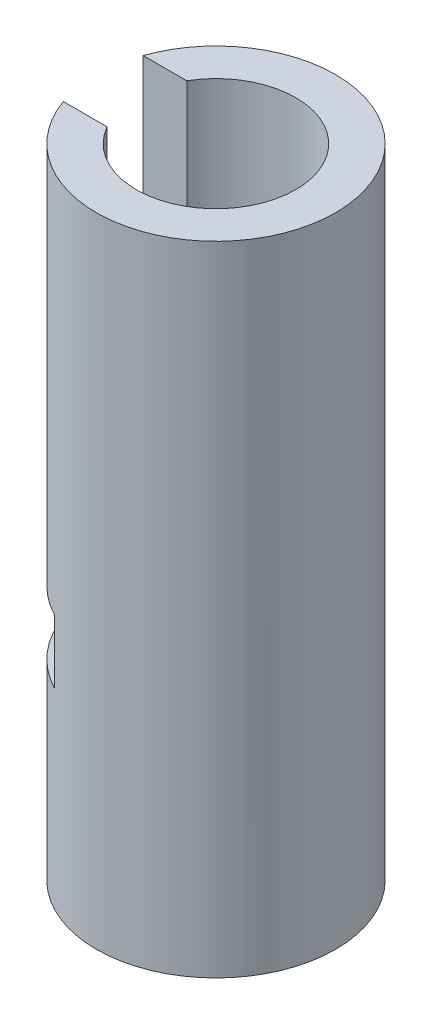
SolidWorks part; units mm, degrees
ref_plane "Front Plane" through (0, 0, 0) normal (0, 0, 1) x (1, 0, 0)
ref_plane "Top Plane" through (0, 0, 0) normal (0, 1, 0) x (1, 0, 0)
ref_plane "Right Plane" through (0, 0, 0) normal (1, 0, 0) x (0, 0, -1)
sketch "Sketch1" plane through (0, 0, 0) normal (0, 1, 0) x (1, 0, 0)
  circle A0 centre (-32.3124, 17.8442) radius 9.525
extrude "Boss-Extrude1" add sketch "Sketch1" along normal blind 50.8
sketch "Sketch2" plane through (0, 50.8, 0) normal (0, 1, 0) x (1, 0, 0)
  circle A0 centre (-32.3124, 17.8442) radius 4.445
  circle A1 centre (-32.3124, 17.8442) radius 9.525 construction
  point P2 (-39.978, 27.9101)
  dimension "D1" = 0
  dimension "D2" = 0
extrude "Cut-Extrude1" cut sketch "Sketch2" against normal blind 44.45
sketch "Sketch3" plane through (0, 50.8, 0) normal (0, 1, 0) x (1, 0, 0)
  circle A0 centre (-32.3124, 17.8442) radius 6.35
  circle A1 centre (-32.3124, 17.8442) radius 4.445 construction
  dimension "D1" = 0
extrude "Cut-Extrude2" cut sketch "Sketch3" against normal blind 25.4
sketch "Sketch4" plane through (0, 50.8, 0) normal (0, 1, 0) x (1, 0, 0)
  line L1 (-32.3124, 21.0192) -> (-49.4513, 21.0192)
  line L2 (-32.3124, 21.0192) -> (-32.3124, 14.6692)
  line L3 (-32.3124, 14.6692) -> (-49.4513, 14.6692)
  line L4 (-49.4513, 21.0192) -> (-49.4513, 14.6692)
  circle A0 centre (-32.3124, 17.8442) radius 4.445 construction
  circle A1 centre (-32.3124, 17.8442) radius 4.445 construction
  dimension "D1" = 3.175
  dimension "D2" = 0
  dimension "D3" = 6.35
extrude "Cut-Extrude3" cut sketch "Sketch4" against normal blind 35.56
sketch "Sketch5" plane through (0, 0, -14.6692) normal (0, 0, -1) x (-1, 0, 0)
  line L1 (41.8374, 15.24) -> (32.3124, 15.24)
  line L2 (41.8374, 15.24) -> (41.8374, 20.32)
  line L3 (41.8374, 20.32) -> (32.3124, 20.32)
  line L4 (32.3124, 15.24) -> (32.3124, 20.32)
revolve "Cut-Revolve2" cut sketch "Sketch5" angle 50 about L4
sketch "Sketch6" plane through (0, 0, -21.0192) normal (0, 0, 1) x (1, 0, 0)
  line L1 (-41.8374, 15.24) -> (-32.3124, 15.24)
  line L2 (-41.8374, 15.24) -> (-41.8374, 20.32)
  line L3 (-41.8374, 20.32) -> (-32.3124, 20.32)
  line L4 (-32.3124, 15.24) -> (-32.3124, 20.32)
revolve "Cut-Revolve6" cut sketch "Sketch6" angle 50 about L4
